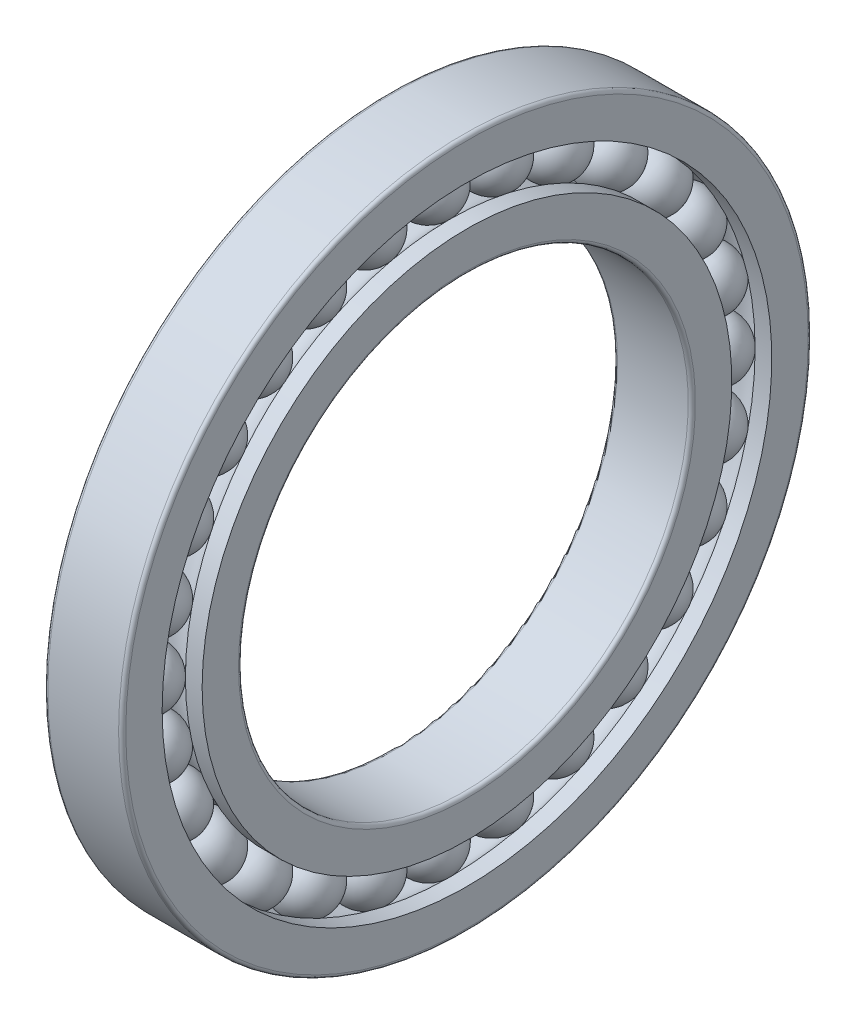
SolidWorks part; units mm, degrees
ref_plane "Front" through (0, 0, 0) normal (0, 0, 1) x (1, 0, 0)
ref_plane "Top" through (0, 0, 0) normal (0, 1, 0) x (1, 0, 0)
ref_plane "Right" through (0, 0, 0) normal (1, 0, 0) x (0, 0, -1)
other "Configuration Table"
sketch "Sketch1" plane through (0, 0, 0) normal (0, 0, 1) x (1, 0, 0)
  line L0 (-9.6833, 0) -> (9.8371, 0) construction
  line L1 (-5, 47.5) -> (5, 47.5)
  line L2 (-4.5966, 47.5) -> (4.6657, 47.5) construction
  arc A0 (5, 47.5) -> (-5, 47.5) centre (0, 47.5) ccw
revolve "Revolve1" add sketch "Sketch1" angle 360 about L2
sketch "Sketch2" plane through (0, 0, 0) normal (0, 0, 1) x (1, 0, 0)
  line L0 (-6.5, 44.1667) -> (-6.5, 37.5)
  line L1 (-6.5, 37.5) -> (6.5, 37.5)
  line L2 (6.5, 37.5) -> (6.5, 44.1667)
  line L3 (6.5, 44.1667) -> (3.7134, 44.1667)
  line L4 (-6.9714, 0) -> (8.1665, 0) construction
  line L5 (-6.7058, 47.5) -> (6.7058, 47.5) construction
  line L6 (-3.7134, 44.1667) -> (-6.5, 44.1667)
  arc A0 (-3.7134, 44.1667) -> (3.7134, 44.1667) centre (0, 47.5) ccw
revolve "Revolve2" add sketch "Sketch2" angle 360 about L4
sketch "Sketch3" plane through (0, 0, 0) normal (0, 0, 1) x (1, 0, 0)
  line L0 (-8.7107, 0) -> (9.1288, 0) construction
  line L1 (-6.5, 57.5) -> (6.5, 57.5)
  line L2 (-6.5, 57.5) -> (-6.5, 50.8333)
  line L3 (-6.5, 50.8333) -> (-3.7134, 50.8333)
  line L4 (6.5, 57.5) -> (6.5, 50.8333)
  line L5 (-7.2948, 47.5) -> (7.2948, 47.5) construction
  line L6 (3.7134, 50.8333) -> (6.5, 50.8333)
  arc A0 (3.7134, 50.8333) -> (-3.7134, 50.8333) centre (0, 47.5) ccw
revolve "Revolve3" add sketch "Sketch3" angle 360 about L0
pattern_circular "Circular-Pattern1" count 28 over 360 about axis through (0, 0, 0) along (1, 0, 0) of "Revolve1"
fillet "Fillet1" radius 0.6 4 edges at (-6.5, 0, 37.5) (-6.5, 0, 57.5) (6.5, 0, 57.5) (6.5, 0, 37.5)
equation "\"d0@Sketch1\" = ( \"DD@Sketch3\" + \"d@Sketch2\" )  / 2"
equation "\"dia@Sketch1\" =  ( \"DD@Sketch3\" - \"d@Sketch2\" )  / 4"
equation "\"D3@Sketch2\" = ( \"DD@Sketch3\" + \"d@Sketch2\" )  / 2 / 2"
equation "\"D4@Sketch2\" = ( \"DD@Sketch3\" - \"d@Sketch2\" )  / 6"
equation "\"D5@Sketch2\" = \"dia@Sketch1\" - 0.02"
equation "\"B/2@Sketch2\" = \"B@Sketch2\" / 2"
equation "\"D4@Sketch3\" = ( \"DD@Sketch3\" + \"d@Sketch2\" )  / 2 / 2"
equation "\"D5@Sketch3\" = ( \"DD@Sketch3\" - \"d@Sketch2\" )  / 6"
equation "\"B@Sketch3\" = \"B@Sketch2\""
equation "\"B/2@Sketch3\" = \"B@Sketch3\" / 2"
equation "\"D1@Sketch3\" = \"dia@Sketch1\" - 0.02"
equation "\"m@Circular-Pattern1\" = int( 3.14159265 / atn(( \"dia@Sketch1\" / 2) / sqr(( \"DD@Sketch3\" + \"d@Sketch2\" )  / 2 * ( \"DD@Sketch3\" + \"d@Sketch2\" )  / 2/4 - ( \"dia@Sketch1\" / 2) *  ( \"dia@Sketch1\" / 2))))-1"
